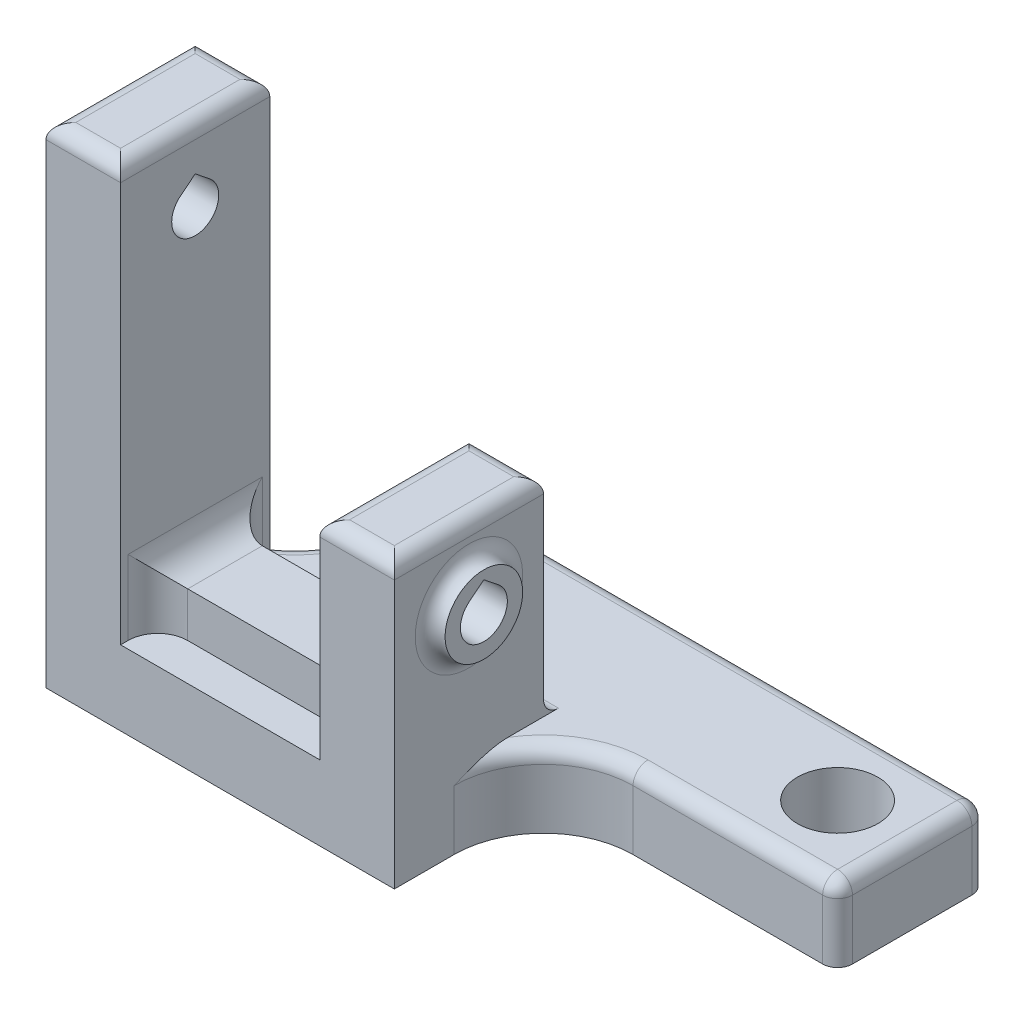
SolidWorks part; units mm, degrees
other "Markup1"
sketch "Sketch8" plane through (-17.3667, 38.5115, 25.4) normal (-0.0434, 0.6708, 0.7404) x (0.9991, 0.0264, 0.0346)
sketch "Sketch9" plane through (-17.3667, 38.5115, 25.4) normal (-0.0434, 0.6708, 0.7404) x (0.9991, 0.0264, 0.0346)
sketch "Sketch10" plane through (-17.3667, 38.5115, 25.4) normal (-0.0434, 0.6708, 0.7404) x (0.9991, 0.0264, 0.0346)
sketch "Sketch15" plane through (-16.0967, 38.5115, 25.4) normal (-0.0434, 0.6708, 0.7404) x (0.9991, 0.0264, 0.0346)
ref_plane "Front Plane" through (0, 0, 0) normal (0, 0, 1) x (1, 0, 0)
ref_plane "Top Plane" through (0, 0, 0) normal (0, 1, 0) x (1, 0, 0)
ref_plane "Right Plane" through (0, 0, 0) normal (1, 0, 0) x (0, 0, -1)
sketch "Sketch1" plane through (0, 0, 0) normal (0, 0, 1) x (1, 0, 0)
  line L1 (8.4767, 3.175) -> (-8.4767, 3.175)
  line L2 (8.4767, 3.175) -> (8.4767, -3.175)
  line L3 (8.4767, -3.175) -> (-8.4767, -3.175)
  line L4 (-8.4767, 3.175) -> (-8.4767, -3.175)
  line L5 (8.4767, 3.175) -> (-8.4767, -3.175) construction
  line L6 (8.4767, -3.175) -> (-8.4767, 3.175) construction
  line L7 (-8.4767, -3.175) -> (-14.8267, -3.175)
  line L8 (-8.4767, -3.175) -> (-8.4767, 38.5115)
  line L9 (-8.4767, 38.5115) -> (-14.8267, 38.5115)
  line L10 (-14.8267, -3.175) -> (-14.8267, 38.5115)
  line L11 (8.4767, -3.175) -> (14.8267, -3.175)
  line L12 (8.4767, -3.175) -> (8.4767, 20.8737)
  line L13 (8.4767, 20.8737) -> (14.8267, 20.8737)
  line L14 (14.8267, -3.175) -> (14.8267, 20.8737)
  line L15 (14.8267, -3.175) -> (31.0827, -3.175)
  line L16 (14.8267, -3.175) -> (14.8267, 3.175)
  line L17 (14.8267, 3.175) -> (31.0827, 3.175)
  line L18 (31.0827, -3.175) -> (31.0827, 3.175)
  line L19 (-14.8267, -3.175) -> (-31.0827, -3.175)
  line L20 (-14.8267, -3.175) -> (-14.8267, 3.175)
  line L21 (-14.8267, 3.175) -> (-31.0827, 3.175)
  line L22 (-31.0827, -3.175) -> (-31.0827, 3.175)
  point P0 (0, 0)
  dimension "D1" = 6.35
  dimension "D2" = 6.35
  dimension "D3" = 29.6534
  dimension "D4" = 24.0487
  dimension "D5" = 16.256
  dimension "D6" = 17.6378
extrude "Boss-Extrude1" add sketch "Sketch1" along normal blind 12.7 contours L1 L4 L3 L2 | L10 L7 L4 L8 L9 | L11 L14 L13 L12 L2 | L22 L19 L10 L21 | L15 L18 L17 L14
sketch "Sketch2" plane through (14.8267, 0, 0) normal (1, 0, 0) x (0, 0, -1)
  line L0 (-12.7, 20.8737) -> (0, 20.8737) construction
  line L1 (-12.7, 19.1214) -> (0, 19.1214) construction
  line L2 (-12.7, 3.175) -> (-12.7, 20.8737) construction
  line L3 (0, 3.175) -> (0, 20.8737) construction
  circle A0 centre (-6.35, 14.5237) radius 2
  point P10 (-6.35, 19.1214)
  dimension "D2" = 4
  dimension "D1" = 6.35
extrude "Cut-Extrude1" cut sketch "Sketch2" against normal up to next
sketch "Sketch3" plane through (0, 3.175, 0) normal (0, 1, 0) x (1, 0, 0)
  line L0 (-25.4, -6.35) -> (25.4, -6.35) construction
  line L3 (-2.1285, 0) -> (-2.1285, -12.7) construction
  line L6 (8.4767, 0) -> (-8.4767, 0) construction
  line L7 (8.4767, -12.7) -> (-8.4767, -12.7) construction
  circle A0 centre (-25.4, -6.35) radius 3.175
  circle A1 centre (25.4, -6.35) radius 3.175
  point P0 (0, -6.35)
  point P7 (-2.1285, -6.35)
  dimension "D1" = 6.35
  dimension "D2" = 50.8
extrude "Cut-Extrude2" cut sketch "Sketch3" against normal up to next
sketch "Sketch4" plane through (-14.8267, 0, 0) normal (-1, 0, 0) x (0, 0, 1)
  line L0 (0, 36.4885) -> (12.7, 36.4885) construction
  line L1 (0, 3.175) -> (0, 38.5115) construction
  line L2 (12.7, 3.175) -> (12.7, 38.5115) construction
  line L3 (12.7, 38.5115) -> (0, 38.5115) construction
  circle A0 centre (6.35, 32.1615) radius 2
  point P9 (6.35, 36.4885)
  dimension "D2" = 4
  dimension "D1" = 6.35
extrude "Cut-Extrude3" cut sketch "Sketch4" against normal up to next
sketch "Sketch5" plane through (0, 3.175, 0) normal (0, 1, 0) x (1, 0, 0)
  line L0 (8.4767, 0) -> (-8.4767, 0) construction
  line L1 (-6.35, 0) -> (6.35, 0)
  line L2 (-6.35, 0) -> (-6.35, 12.7)
  line L3 (-6.35, 12.7) -> (6.35, 12.7)
  line L4 (6.35, 0) -> (6.35, 12.7)
  line L5 (8.4767, -12.7) -> (-8.4767, -12.7) construction
  line L6 (-6.35, -12.7) -> (6.35, -12.7)
  line L7 (-6.35, -12.7) -> (-6.35, -25.4)
  line L8 (-6.35, -25.4) -> (6.35, -25.4)
  line L9 (6.35, -12.7) -> (6.35, -25.4)
  circle A0 centre (0, 6.35) radius 3.429
  circle A1 centre (0, -19.05) radius 3.429
  point P16 (0, 12.7)
  point P20 (-6.35, 6.35)
  point P22 (-6.35, -19.05)
  point P24 (0, -12.7)
  dimension "D1" = 6.858
  dimension "D2" = 12.7
  dimension "D3" = 12.7
extrude "Boss-Extrude2" add sketch "Sketch5" against normal up to surface (6.35 mm away)
sketch "Sketch6" plane through (0, 3.175, 0) normal (0, 1, 0) x (1, 0, 0)
  line L0 (14.8267, -12.7) -> (14.8267, 0) construction
  line L1 (-14.8267, 2.5418) -> (-39.8374, 2.5418)
  line L2 (-14.8267, 2.5418) -> (-14.8267, -18.8261)
  line L3 (-14.8267, -18.8261) -> (-39.8374, -18.8261)
  line L4 (-39.8374, 2.5418) -> (-39.8374, -18.8261)
  line L5 (14.8267, 4.3339) -> (36.5977, 4.3339)
  line L6 (14.8267, 4.3339) -> (14.8267, -23.7889)
  line L7 (14.8267, -23.7889) -> (36.5977, -23.7889)
  line L8 (36.5977, 4.3339) -> (36.5977, -23.7889)
  line L9 (-14.8267, -12.7) -> (-14.8267, 0) construction
extrude "Cut-Extrude4" cut sketch "Sketch6" against normal up to surface (6.35 mm away)
sketch "Sketch7" plane through (0, 3.175, 0) normal (0, 1, 0) x (1, 0, 0)
  line L0 (-8.4767, -12.7) -> (-8.4767, 0) construction
  line L1 (-8.4767, -3.175) -> (8.4767, -3.175)
  line L2 (-8.4767, -3.175) -> (-8.4767, -9.525)
  line L3 (-8.4767, -9.525) -> (8.4767, -9.525)
  line L4 (8.4767, -3.175) -> (8.4767, -9.525)
  line L5 (8.4767, -12.7) -> (8.4767, 0) construction
  line L6 (14.8267, -12.7) -> (14.8267, 0) construction
  point P10 (14.8267, -6.35)
  point P11 (8.4767, -6.35)
  dimension "D1" = 6.35
extrude "Boss-Extrude3" add sketch "Sketch7" along normal blind 3.81
fillet "Fillet1" radius 2.54 6 edges at (8.4767, 5.08, 3.175) (8.4767, 5.08, 9.525) (8.4767, 6.985, 6.35) (-8.4767, 5.08, 3.175) (-8.4767, 5.08, 9.525) (-8.4767, 6.985, 6.35)
sketch "Sketch11" plane through (14.8267, 0, 0) normal (1, 0, 0) x (0, 0, -1)
  circle A0 centre (-6.35, 14.5237) radius 3.302
  circle A1 centre (-6.35, 14.5237) radius 2
  circle A2 centre (-6.35, 14.5237) radius 2 construction
  dimension "D1" = 6.604
extrude "Boss-Extrude4" add sketch "Sketch11" along normal blind 1.27
sketch "Sketch12" plane through (-14.8267, 0, 0) normal (-1, 0, 0) x (0, 0, 1)
  circle A0 centre (6.35, 32.1615) radius 3.302
  circle A1 centre (6.35, 32.1615) radius 2
  circle A2 centre (6.35, 32.1615) radius 2 construction
  dimension "D1" = 6.604
extrude "Boss-Extrude5" add sketch "Sketch12" along normal blind 1.27
sketch "Sketch13" plane through (-8.4767, 0, 0) normal (1, 0, 0) x (0, 0, -1)
  line L0 (-6.35, 34.723) -> (-5.1004, 33.723)
  line L1 (-5.1004, 33.723) -> (-7.5996, 33.723)
  line L2 (-7.5996, 33.723) -> (-6.35, 34.723)
  circle A0 centre (-6.35, 32.1615) radius 2 construction
  point P3 (-6.35, 33.723)
  dimension "D1" = 1
extrude "Cut-Extrude5" cut sketch "Sketch13" against normal up to surface (7.62 mm away)
sketch "Sketch14" plane through (8.4767, 0, 0) normal (-1, 0, 0) x (0, 0, 1)
  line L0 (5.1004, 16.0853) -> (6.35, 17.0853)
  line L1 (6.35, 17.0853) -> (7.5996, 16.0853)
  line L2 (7.5996, 16.0853) -> (5.1004, 16.0853)
  circle A0 centre (6.35, 14.5237) radius 2 construction
  point P7 (6.35, 16.0853)
  dimension "D1" = 1
extrude "Cut-Extrude6" cut sketch "Sketch14" against normal up to surface (7.62 mm away)
fillet "Fillet4" radius 1.27 8 edges at (-8.4767, 38.5115, 6.35) (-11.6517, 38.5115, 0) (-11.6517, 38.5115, 12.7) (-14.8267, 38.5115, 6.35) (14.8267, 20.8737, 6.35) (11.6517, 20.8737, 0) (11.6517, 20.8737, 12.7) (8.4767, 20.8737, 6.35)
fillet "Fillet2" [suppressed] radius 2.54
fillet "Fillet7" radius 1.27 2 edges at (-14.8267, 32.1615, 9.652) (14.8267, 14.5237, 9.652)
sketch "Sketch16" plane through (0, 3.175, 0) normal (0, 1, 0) x (1, 0, 0)
  line L0 (6.35, 12.7) -> (-6.35, 12.7) construction
  line L1 (6.35, 0) -> (39.8556, 0)
  line L2 (6.35, 0) -> (6.35, 12.7)
  line L3 (6.35, 12.7) -> (39.8556, 12.7)
  line L4 (39.8556, 0) -> (39.8556, 12.7)
  circle A0 centre (33.5056, 6.35) radius 3.429
  circle A1 centre (0, 6.35) radius 3.429 construction
  point P9 (0, 0)
  point P10 (39.8556, 6.35)
  dimension "D1" = 33.5056
  dimension "D2" = 6.35
extrude "Boss-Extrude6" add sketch "Sketch16" against normal up to surface (6.35 mm away)
sketch "Sketch18" plane through (0, 3.175, 0) normal (0, 1, 0) x (1, 0, 0)
  line L0 (8.4767, -12.7) -> (6.35, -12.7) construction
  line L1 (-13.6425, -12.7) -> (14.9192, -12.7)
  line L2 (-13.6425, -12.7) -> (-13.6425, -25.8912)
  line L3 (-13.6425, -25.8912) -> (14.9192, -25.8912)
  line L4 (14.9192, -12.7) -> (14.9192, -25.8912)
extrude "Cut-Extrude7" cut sketch "Sketch18" against normal up to surface (6.35 mm away)
fillet "Fillet9" radius 7.62 2 edges at (-6.35, 0, 0) (14.8267, 0, 0)
fillet "Fillet12" radius 1.27 8 edges at (39.8556, 0, 0) (39.8556, 0, -12.7) (39.8556, 3.175, -6.35) (17.0585, 3.175, 2.2318) (-8.5818, 3.175, -2.2318) (-6.35, 0, -12.7) (-6.35, 3.175, -10.16) (16.7528, 3.175, -12.7)
fillet "Fillet13" radius 1.27 1 edges at (11.6517, 3.175, 0)
